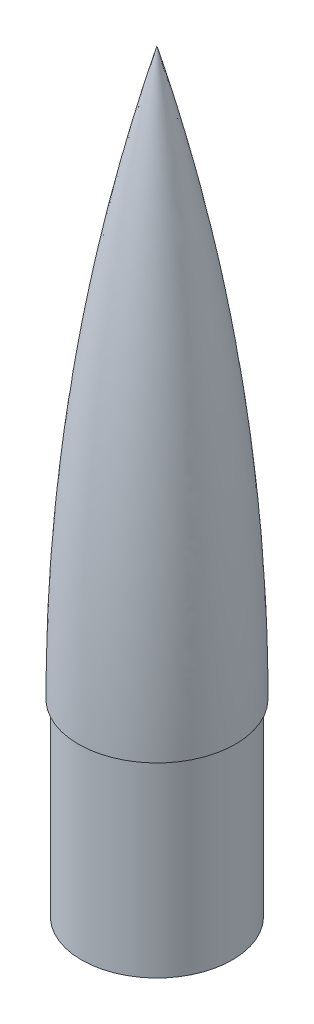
SolidWorks part; units mm, degrees
ref_plane "Front Plane" through (0, 0, 0) normal (0, 0, 1) x (1, 0, 0)
ref_plane "Top Plane" through (0, 0, 0) normal (0, 1, 0) x (1, 0, 0)
ref_plane "Right Plane" through (0, 0, 0) normal (1, 0, 0) x (0, 0, -1)
sketch "Sketch1" plane through (0, 0, 0) normal (0, 0, 1) x (1, 0, 0)
  line L0 (0, 0) -> (-38.1, 0)
  line L1 (-38.1, 95.25) -> (-38.1, 0)
  line L2 (-38.1, 0) -> (-38.1, 0.3532)
  line L3 (-38.1, 95.25) -> (-39.6875, 95.25)
  line L4 (0, 381) -> (0, 0) construction
  arc A0 (-39.6875, 95.25) -> (0, 381) centre (1008.8562, 95.25) cw
  dimension "D1" = 38.1
  dimension "D2" = 95.25
  dimension "D3" = 1.5875
  dimension "D4" = 381
revolve "Revolve1" add sketch "Sketch1" angle 360 about L4
shell "Shell1" thickness 1.5875
